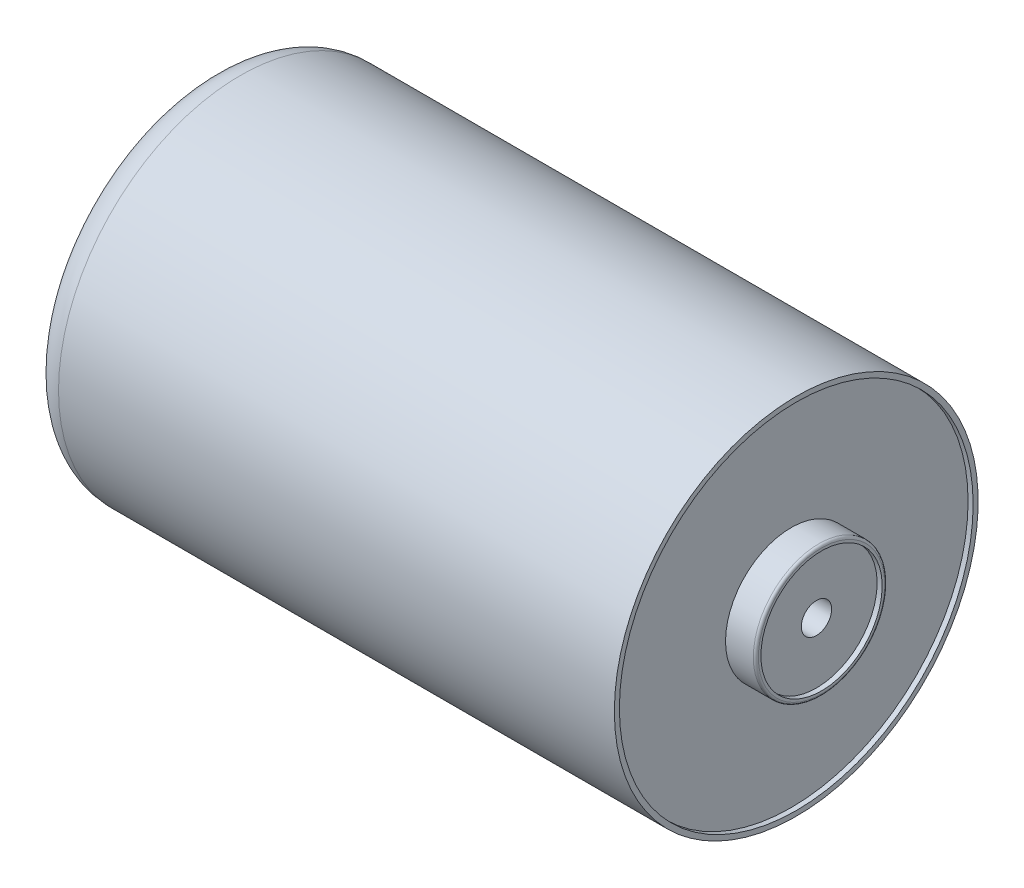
SolidWorks part; units mm, degrees
ref_plane "Face" through (0, 0, 0) normal (0, 0, 1) x (1, 0, 0)
ref_plane "Dessus" through (0, 0, 0) normal (0, 1, 0) x (1, 0, 0)
ref_plane "Droite" through (0, 0, 0) normal (1, 0, 0) x (0, 0, -1)
sketch "Esquisse1" plane through (0, 0, 0) normal (0, 0, 1) x (1, 0, 0)
  line L0 (0, 0) -> (118.4476, 0) construction
  line L1 (15.5714, 1.5) -> (6.4735, 1.5)
  line L2 (6.4735, 1.5) -> (6.4735, 6)
  line L3 (6.4735, 6) -> (5.9735, 6)
  line L4 (5.9735, 6) -> (5.9735, 6.5)
  line L5 (5.9735, 6.5) -> (10.4735, 6.5)
  line L6 (10.4735, 6.5) -> (10.4735, 18)
  line L7 (10.4735, 18) -> (68.4735, 18)
  line L8 (68.4735, 18) -> (68.4735, 17.503)
  line L9 (68.4735, 17.503) -> (67.9735, 17.503)
  line L10 (67.9735, 17.503) -> (67.9735, 6.5)
  line L11 (67.9735, 6.5) -> (70.9735, 6.5)
  line L12 (70.9735, 6.5) -> (70.9735, 6)
  line L13 (70.9735, 6) -> (70.4735, 6)
  line L14 (70.4735, 6) -> (70.4735, 1.5)
  line L15 (70.4735, 1.5) -> (15.5714, 1.5)
  dimension "D1" = 3
  dimension "D2" = 0.5
  dimension "D3" = 12
  dimension "D4" = 13
  dimension "D5" = 36
  dimension "D6" = 4.5
  dimension "D7" = 58
  dimension "D8" = 12
  dimension "D9" = 0.5
  dimension "D10" = 0.5
  dimension "D11" = 0.5
  dimension "D12" = 3
revolve "Révolution1" add sketch "Esquisse1" angle 360 about L0
fillet "Congé1" radius 0.25
fillet "Congé2" radius 3
sketch "Esquisse2" plane through (10.4735, 0, 0) normal (-1, 0, 0) x (0, 0, 1)
  line L0 (0, 0) -> (0, -19.9352) construction
  circle A0 centre (12.5, 0) radius 1
  circle A1 centre (-12.5, 0) radius 1
  dimension "D1" = 2
  dimension "D2" = 12.5
extrude "Enlèv. mat.-Extru.1" cut sketch "Esquisse2" against normal blind 10
